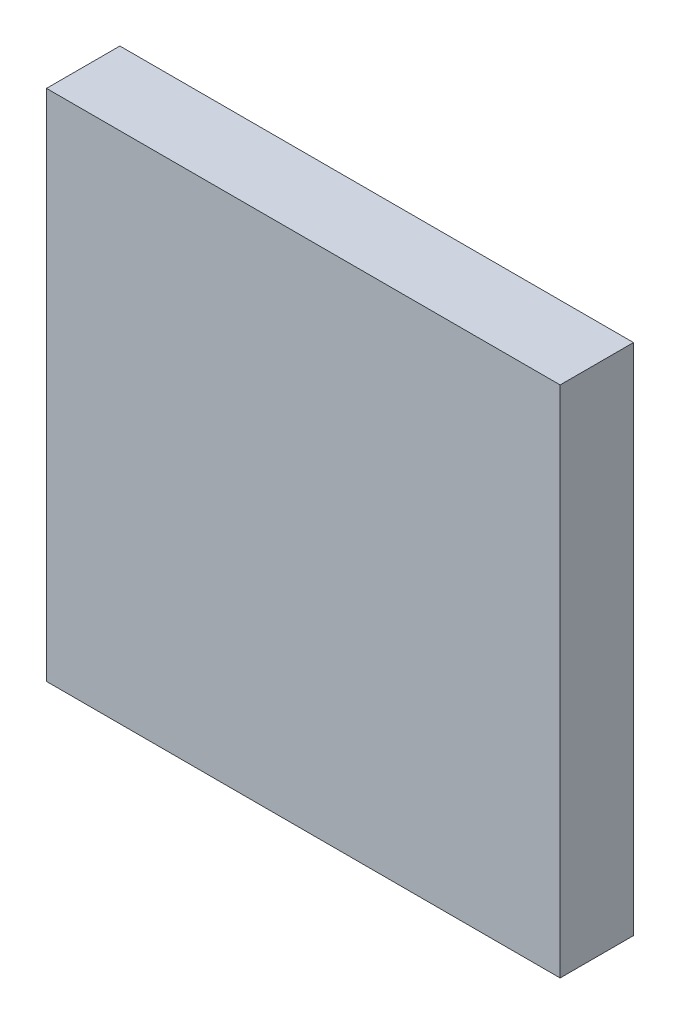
SolidWorks part; units mm, degrees
ref_plane "Front Plane" through (0, 0, 0) normal (0, 0, 1) x (1, 0, 0)
ref_plane "Top Plane" through (0, 0, 0) normal (0, 1, 0) x (1, 0, 0)
ref_plane "Right Plane" through (0, 0, 0) normal (1, 0, 0) x (0, 0, -1)
sketch "Sketch1" plane through (0, 0, 0) normal (0, 0, 1) x (1, 0, 0)
  line L1 (0, 0) -> (70, 0)
  line L2 (0, 0) -> (0, 70)
  line L3 (0, 70) -> (70, 70)
  line L4 (70, 0) -> (70, 70)
  dimension "D1" = 70
extrude "Boss-Extrude1" add sketch "Sketch1" along normal blind 10
